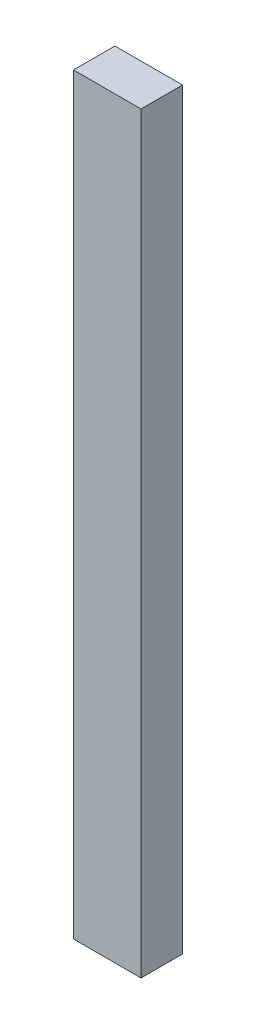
SolidWorks part; units mm, degrees
ref_plane "Plan de face" through (0, 0, 0) normal (0, 0, 1) x (1, 0, 0)
ref_plane "Plan de dessus" through (0, 0, 0) normal (0, 1, 0) x (1, 0, 0)
ref_plane "Plan de droite" through (0, 0, 0) normal (1, 0, 0) x (0, 0, -1)
sketch "Esquisse1" plane through (0, 0, 0) normal (0, 1, 0) x (1, 0, 0)
  line L1 (-35, 21.5) -> (35, 21.5)
  line L2 (-35, 21.5) -> (-35, -21.5)
  line L3 (-35, -21.5) -> (35, -21.5)
  line L4 (35, 21.5) -> (35, -21.5)
  line L5 (-35, 21.5) -> (35, -21.5) construction
  line L6 (-35, -21.5) -> (35, 21.5) construction
  point P0 (0, 0)
  dimension "D1" = 43
  dimension "D2" = 70
extrude "Boss.-Extru.1" add sketch "Esquisse1" along normal blind 780
